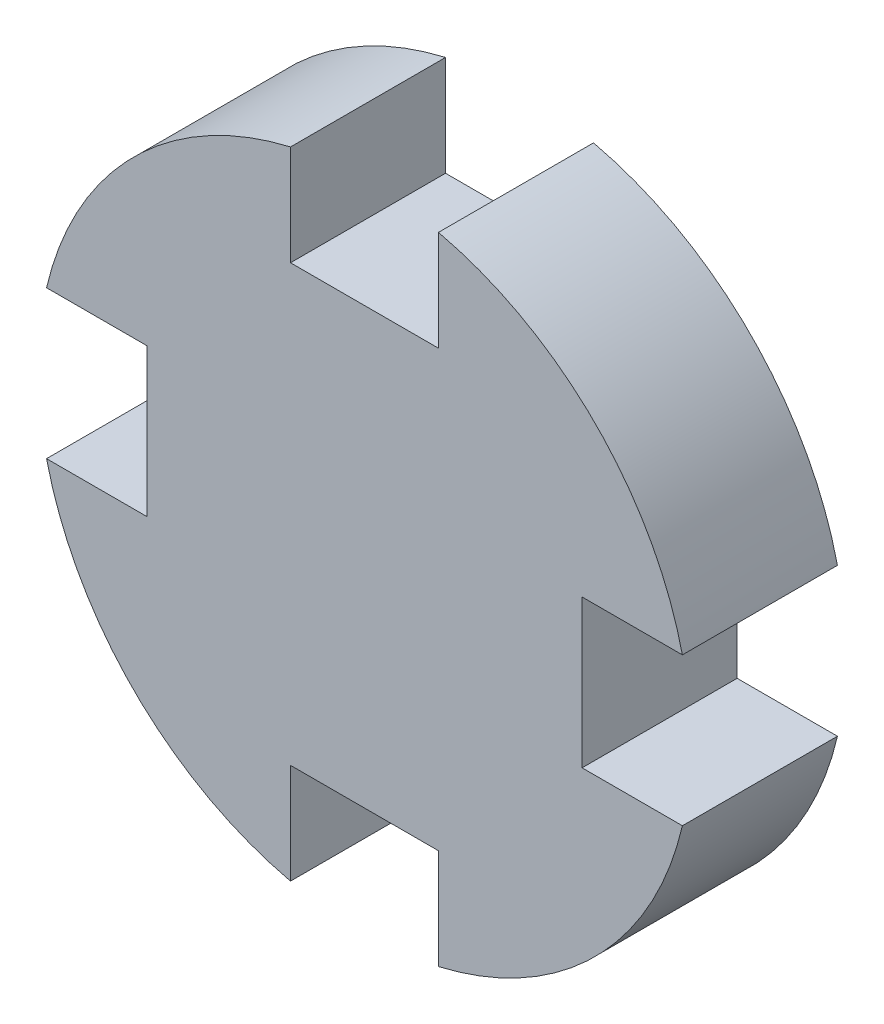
SolidWorks part; units mm, degrees
ref_plane "Piano frontale" through (0, 0, 0) normal (0, 0, 1) x (1, 0, 0)
ref_plane "Piano superiore" through (0, 0, 0) normal (0, 1, 0) x (1, 0, 0)
ref_plane "Piano destro" through (0, 0, 0) normal (1, 0, 0) x (0, 0, -1)
sketch "Sketch3" plane through (0, 0, 0) normal (0, 0, 1) x (1, 0, 0)
  circle A0 centre (0, 0) radius 12
extrude "Boss-Extrude2" add sketch "Sketch3" along normal blind 5.7
sketch "Sketch4" plane through (0, 0, 5.7) normal (0, 0, 1) x (1, 0, 0)
  line L0 (12, -2.72) -> (12, 2.72)
  line L1 (12, 2.72) -> (8, 2.72)
  line L2 (8, 2.72) -> (8, -2.72)
  line L3 (8, -2.72) -> (12, -2.72)
  line L4 (8, 0) -> (-10.4453, 0) construction
  point P5 (12, 0)
extrude "Cut-Extrude3" cut sketch "Sketch4" against normal blind 10
pattern_circular "CirPattern3" count 4 over 360 about axis through (0, 0, 0) along (0, 0, 1) of "Cut-Extrude3"
equation "\"r\"= 12"
equation "\"h\"= 5.7mm"
equation "\"D1@Sketch4\" = \"h\" - 2 * \"kerf\""
equation "\"D2@Sketch4\"= \"r\" / 3"
equation "\"D1@Boss-Extrude2\"=\"h\""
equation "\"D1@Sketch3\"= \"r\" * 2"
equation "\"D3@Sketch4\"= \"r\""
equation "\"kerf\"= 0.13mm"
